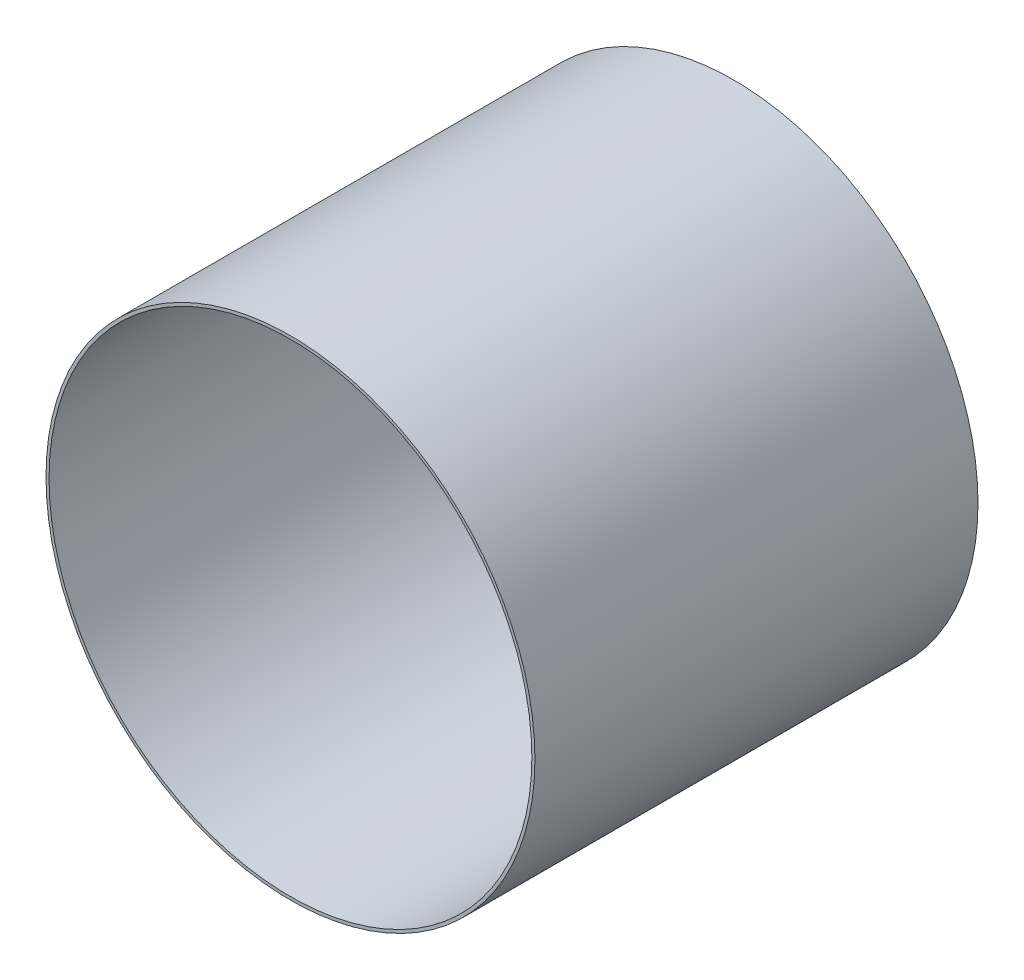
SolidWorks part; units mm, degrees
ref_plane "Front Plane" through (0, 0, 0) normal (0, 0, 1) x (1, 0, 0)
ref_plane "Top Plane" through (0, 0, 0) normal (0, 1, 0) x (1, 0, 0)
ref_plane "Right Plane" through (0, 0, 0) normal (1, 0, 0) x (0, 0, -1)
sketch "Sketch1" plane through (0, 0, 0) normal (0, 0, 1) x (1, 0, 0)
  circle A0 centre (0, 0) radius 160
  circle A1 centre (0, 0) radius 158
  dimension "D1" = 320
  dimension "D2" = 2
extrude "Boss-Extrude1" add sketch "Sketch1" along normal blind 290
